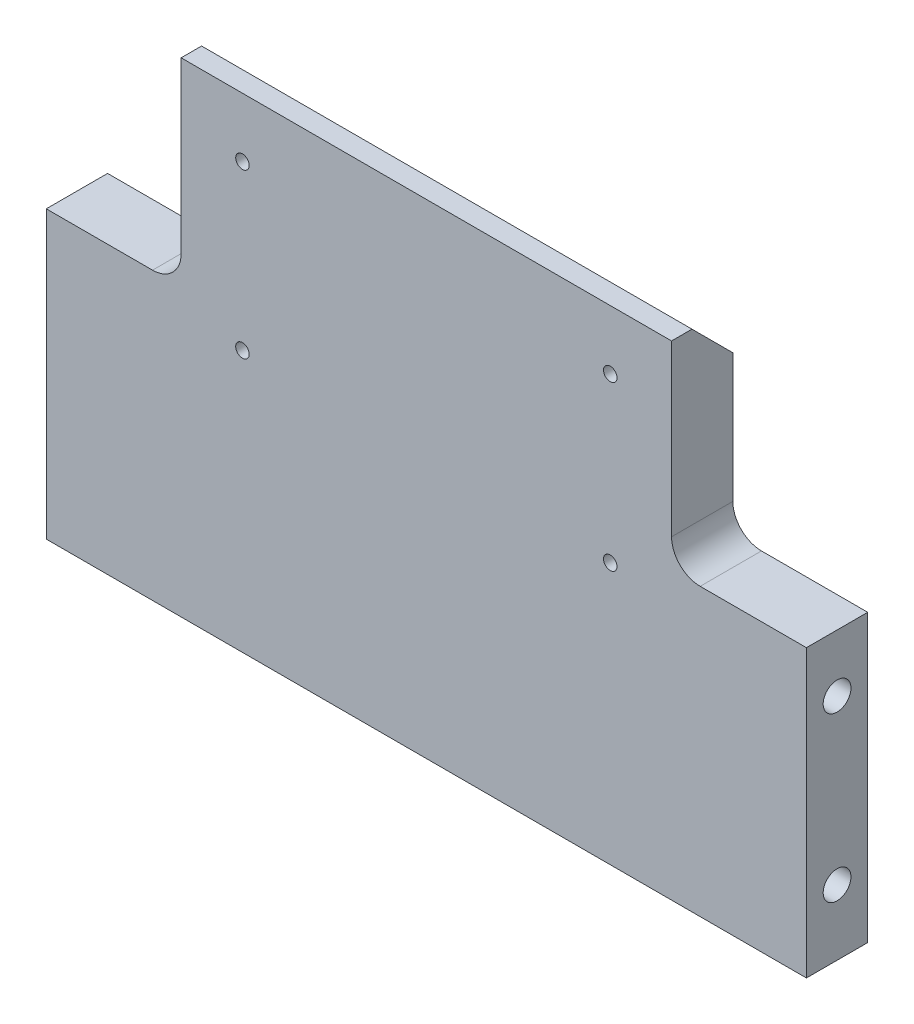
SolidWorks part; units mm, degrees
ref_plane "Face" through (0, 0, 0) normal (0, 0, 1) x (1, 0, 0)
ref_plane "Dessus" through (0, 0, 0) normal (0, 1, 0) x (1, 0, 0)
ref_plane "Droite" through (0, 0, 0) normal (1, 0, 0) x (0, 0, -1)
sketch "Esquisse1" plane through (0, 0, 0) normal (0, 0, 1) x (1, 0, 0)
  line L1 (-84.3266, 52.5511) -> (101.6734, 52.5511)
  line L2 (-84.3266, 52.5511) -> (-84.3266, -77.4489)
  line L3 (-84.3266, -77.4489) -> (101.6734, -77.4489)
  line L4 (101.6734, 52.5511) -> (101.6734, -77.4489)
  dimension "D1" = 130
  dimension "D2" = 186
extrude "Base-Extrusion" add sketch "Esquisse1" along normal blind 15
sketch "Esquisse2" plane through (0, 0, 15) normal (0, 0, 1) x (1, 0, 0)
  line L0 (101.6734, 52.5511) -> (-84.3266, 52.5511) construction
  line L1 (-84.3266, 52.5511) -> (-51.3266, 52.5511)
  line L2 (-84.3266, 52.5511) -> (-84.3266, -7.4489)
  line L3 (-84.3266, -7.4489) -> (-51.3266, -7.4489)
  line L4 (-51.3266, 52.5511) -> (-51.3266, -7.4489)
  line L5 (68.6734, 52.5511) -> (101.6734, 52.5511)
  line L6 (68.6734, 52.5511) -> (68.6734, -7.4489)
  line L7 (68.6734, -7.4489) -> (101.6734, -7.4489)
  line L8 (101.6734, 52.5511) -> (101.6734, -7.4489)
  line L9 (101.6734, -77.4489) -> (101.6734, 52.5511) construction
  dimension "D1" = 60
  dimension "D2" = 60
  dimension "D3" = 120
  dimension "D4" = 33
extrude "Enlèv. mat.-Extru.1" cut sketch "Esquisse2" against normal blind 15
hole_wizard "Trou taraudé M8x1.251" positions "Esquisse4" profile "Esquisse3" tap size "M8x1.25" standard "ISO"
sketch "Esquisse4" plane through (-84.3266, 0, 0) normal (-1, 0, 0) x (0, 0, 1)
  line L0 (15, -77.4489) -> (0, -77.4489) construction
  line L1 (15, -7.4489) -> (15, -77.4489) construction
  point P0 (7.5, -61.4489)
  point P5 (7.5, -21.4489)
  dimension "D1" = 16
  dimension "D2" = 7.5
  dimension "D3" = 40
sketch "Esquisse3" plane through (-84.3266, -61.4489, 7.5) normal (0, 1, 0) x (0, 0, 1)
  line L0 (0, 0) -> (0, 48.2929)
  line L1 (0, 48.2929) -> (3.4, 46.25)
  line L2 (3.4, 46.25) -> (3.4, 0)
  line L5 (3.4, 0) -> (0, 0)
  line L10 (0, 48.2929) -> (-3.4, 46.25) construction
  line L11 (0, -6.35) -> (0, 107.95) construction
  dimension "Diamètre du perçage" = 6.8
  dimension "Profondeur du perçage" = 46.25
  dimension "Angle de pointe" = 118
hole_wizard "Trou taraudé M8x1.252" positions "Esquisse6" profile "Esquisse5" tap size "M8x1.25" standard "ISO"
sketch "Esquisse6" plane through (101.6734, 0, 0) normal (1, 0, 0) x (0, 0, -1)
  line L0 (0, -77.4489) -> (0, -7.4489) construction
  line L1 (-15, -77.4489) -> (0, -77.4489) construction
  point P0 (-7.5, -61.4489)
  point P5 (-7.5, -21.4489)
  dimension "D1" = 7.5
  dimension "D2" = 16
  dimension "D3" = 40
sketch "Esquisse5" plane through (101.6734, -61.4489, 7.5) normal (0, 1, 0) x (0, 0, -1)
  line L0 (0, 0) -> (0, 48.2929)
  line L1 (0, 48.2929) -> (3.4, 46.25)
  line L2 (3.4, 46.25) -> (3.4, 0)
  line L5 (3.4, 0) -> (0, 0)
  line L10 (0, 48.2929) -> (-3.4, 46.25) construction
  line L11 (0, -6.35) -> (0, 107.95) construction
  dimension "Diamètre du perçage" = 6.8
  dimension "Profondeur du perçage" = 46.25
  dimension "Angle de pointe" = 118
fillet "Congé1" radius 7 2 edges at (-51.3266, -7.4489, 7.5) (68.6734, -7.4489, 7.5)
hole_wizard "Trou taraudé M4x0.71" positions "Esquisse8" profile "Esquisse7" tap size "M4x0.7" standard "ISO"
sketch "Esquisse8" plane through (0, 0, 15) normal (0, 0, 1) x (1, 0, 0)
  line L0 (-51.3266, -0.4489) -> (-51.3266, 52.5511) construction
  line L1 (68.6734, 52.5511) -> (-51.3266, 52.5511) construction
  line L2 (68.6734, 52.5511) -> (68.6734, -0.4489) construction
  point P0 (-36.3266, 26.5511)
  point P1 (53.6734, 26.5511)
  point P2 (53.6734, -13.4489)
  point P3 (-36.3266, -13.4489)
  dimension "D1" = 15
  dimension "D2" = 15
  dimension "D3" = 15
  dimension "D4" = 15
  dimension "D5" = 26
  dimension "D6" = 40
  dimension "D7" = 40
  dimension "D8" = 26
sketch "Esquisse7" plane through (-36.3266, 26.5511, 15) normal (1, 0, 0) x (0, -1, 0)
  line L0 (0, 0) -> (0, 15)
  line L1 (0, 15) -> (1.65, 15)
  line L2 (1.65, 15) -> (1.65, 0)
  line L5 (1.65, 0) -> (0, 0)
  line L11 (0, -6.35) -> (0, 107.95) construction
  dimension "Diamètre du trou pour taraudage jusqu'au prochain" = 3.3
  dimension "Profondeur du trou pour taraudage jusqu'au prochain" = 15
sketch "Esquisse12" plane through (0, 0, 15) normal (0, 0, 1) x (1, 0, 0)
  line L0 (68.6734, 52.5511) -> (68.6734, -0.4489) construction
  line L1 (-51.3266, 52.5511) -> (68.6734, 52.5511)
  line L2 (-51.3266, 52.5511) -> (-51.3266, 41.0511)
  line L3 (-51.3266, 41.0511) -> (68.6734, 41.0511)
  line L4 (68.6734, 52.5511) -> (68.6734, 41.0511)
  dimension "D1" = 11.5
extrude "Enlèv. mat.-Extru.5" cut sketch "Esquisse12" against normal blind 40
chamfer "Chanfrein1" distance 10 angle 45 1 edges at (8.6734, 41.0511, 0)
